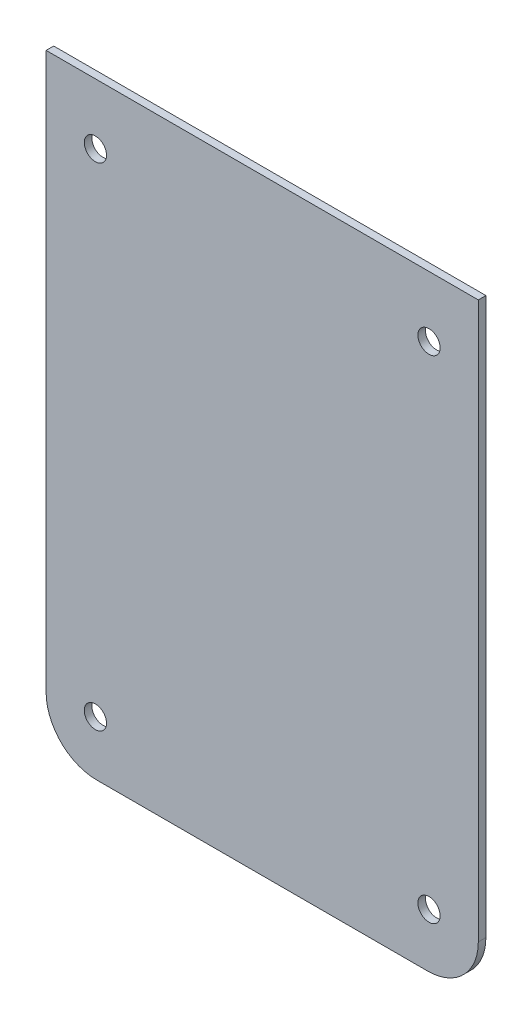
SolidWorks part; units mm, degrees
ref_plane "Front Plane" through (0, 0, 0) normal (0, 0, 1) x (1, 0, 0)
ref_plane "Top Plane" through (0, 0, 0) normal (0, 1, 0) x (1, 0, 0)
ref_plane "Right Plane" through (0, 0, 0) normal (1, 0, 0) x (0, 0, -1)
sketch "Sketch1" plane through (0, 0, 0) normal (0, 0, 1) x (1, 0, 0)
  line L0 (55, 0) -> (-55, 0) construction
  line L1 (-42.75, 0) -> (42.75, 0)
  line L2 (-42.75, 0) -> (-42.75, 120)
  line L3 (-42.75, 120) -> (42.75, 120)
  line L4 (42.75, 0) -> (42.75, 120)
  dimension "D1" = 120
  dimension "D2" = 42.75
  dimension "D3" = 42.75
extrude "Boss-Extrude1" add sketch "Sketch1" against normal blind 1.5
fillet "Fillet1" radius 10 2 edges at (42.75, 0, -0.75) (-42.75, 0, -0.75)
sketch "Sketch2" plane through (0, 0, 0) normal (0, 0, 1) x (1, 0, 0)
  line L0 (0, 0) -> (0, 123.2689) construction
  line L1 (-32.75, 0) -> (32.75, 0) construction
  line L2 (-57.4675, 10.7) -> (62.1086, 10.7) construction
  line L3 (-55.147, 108) -> (58.0135, 108) construction
  line L4 (-33, 10.7) -> (-33, 125.9989) construction
  line L5 (33, 10.7) -> (33, 125.9989) construction
  circle A0 centre (-33, 108) radius 2.2
  circle A1 centre (33, 108) radius 2.2
  circle A2 centre (-33, 10.7) radius 2.2
  circle A3 centre (33, 10.7) radius 2.2
  dimension "D3" = 4.4
  dimension "D4" = 4.4
  dimension "D5" = 4.4
  dimension "D6" = 4.4
  dimension "D1" = 10.7
  dimension "D2" = 97.3
  dimension "D7" = 33
  dimension "D8" = 33
extrude "Cut-Extrude1" cut sketch "Sketch2" against normal through all
